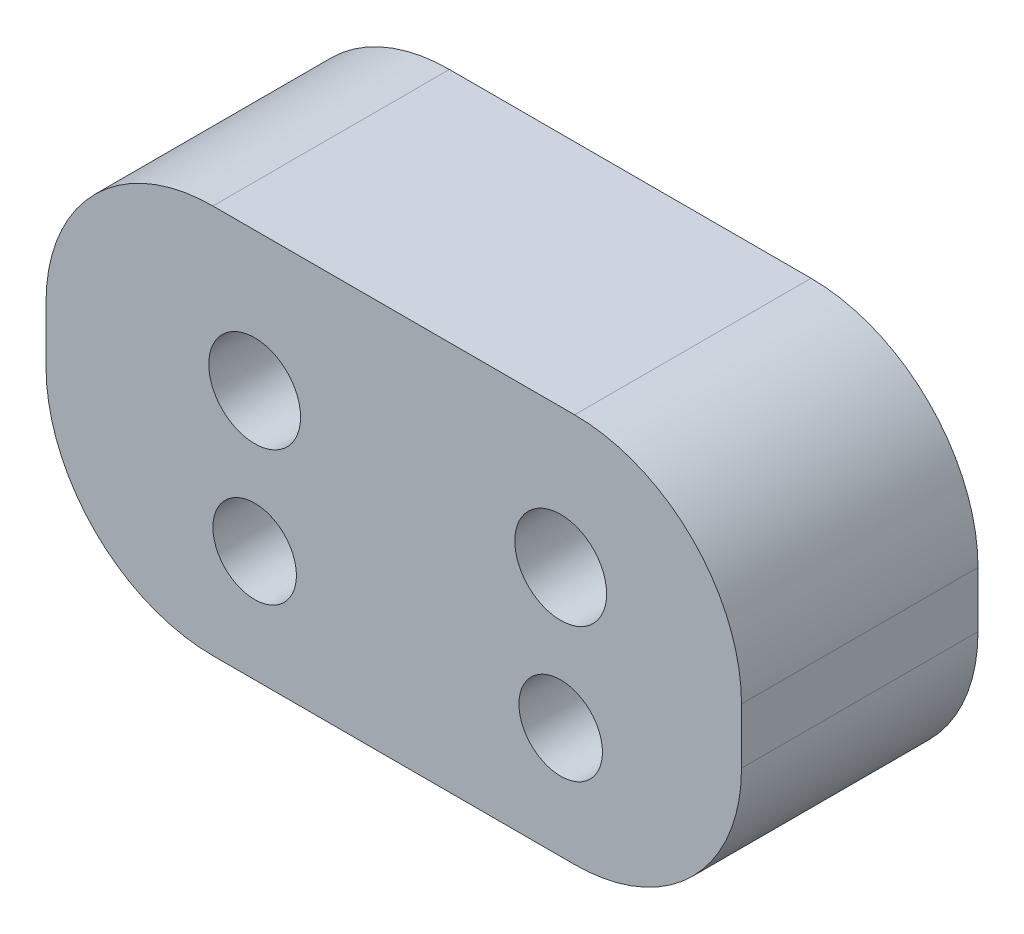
SolidWorks part; units mm, degrees
ref_plane "Plan de face" through (0, 0, 0) normal (0, 0, 1) x (1, 0, 0)
ref_plane "Plan de dessus" through (0, 0, 0) normal (0, 1, 0) x (1, 0, 0)
ref_plane "Plan de droite" through (0, 0, 0) normal (1, 0, 0) x (0, 0, -1)
sketch "Esquisse1" plane through (0, 0, 0) normal (0, 0, 1) x (1, 0, 0)
  line L0 (6, -14) -> (19, -14)
  line L1 (25, -8) -> (25, -6)
  line L2 (19, 0) -> (6, 0)
  line L3 (0, -6) -> (0, -8)
  line L5 (7.5, -5) -> (18.5, -5) construction
  line L6 (7.5, -5) -> (7.5, -10) construction
  line L7 (7.5, -10) -> (18.5, -10) construction
  line L8 (18.5, -5) -> (18.5, -10) construction
  arc A0 (19, -14) -> (25, -8) centre (19, -8) ccw
  arc A1 (25, -6) -> (19, 0) centre (19, -6) ccw
  arc A2 (6, 0) -> (0, -6) centre (6, -6) ccw
  arc A3 (0, -8) -> (6, -14) centre (6, -8) ccw
  circle A6 centre (7.5, -10) radius 1.5
  circle A7 centre (18.5, -10) radius 1.5
  point P14 (18.5, -5)
  point P15 (7.5, -5)
  dimension "D1" = 7.5
  dimension "D2" = 11
  dimension "D3" = 4
  dimension "D4" = 5
extrude "Boss.-Extru.1" add sketch "Esquisse1" against normal blind 8.5
hole_wizard "Trou pour taraudage pour trou taraudé M42" positions "Esquisse6" profile "Esquisse7" hole size "M4" standard "ISO"
sketch "Esquisse6" plane through (0, 0, 0) normal (0, 0, 1) x (1, 0, 0)
  point P0 (7.5, -5)
  point P3 (18.5, -5)
sketch "Esquisse7" plane through (7.5, -5, 0) normal (1, 0, 0) x (0, -1, 0)
  line L0 (0, 0) -> (0, 8.5)
  line L1 (0, 8.5) -> (1.65, 8.5)
  line L2 (1.65, 8.5) -> (1.65, 0)
  line L5 (1.65, 0) -> (0, 0)
  line L11 (0, -6.35) -> (0, 107.95) construction
  dimension "Diamètre du perçage jusqu'au prochain" = 3.3
  dimension "Profondeur du perçage jusqu'au prochain" = 8.5
